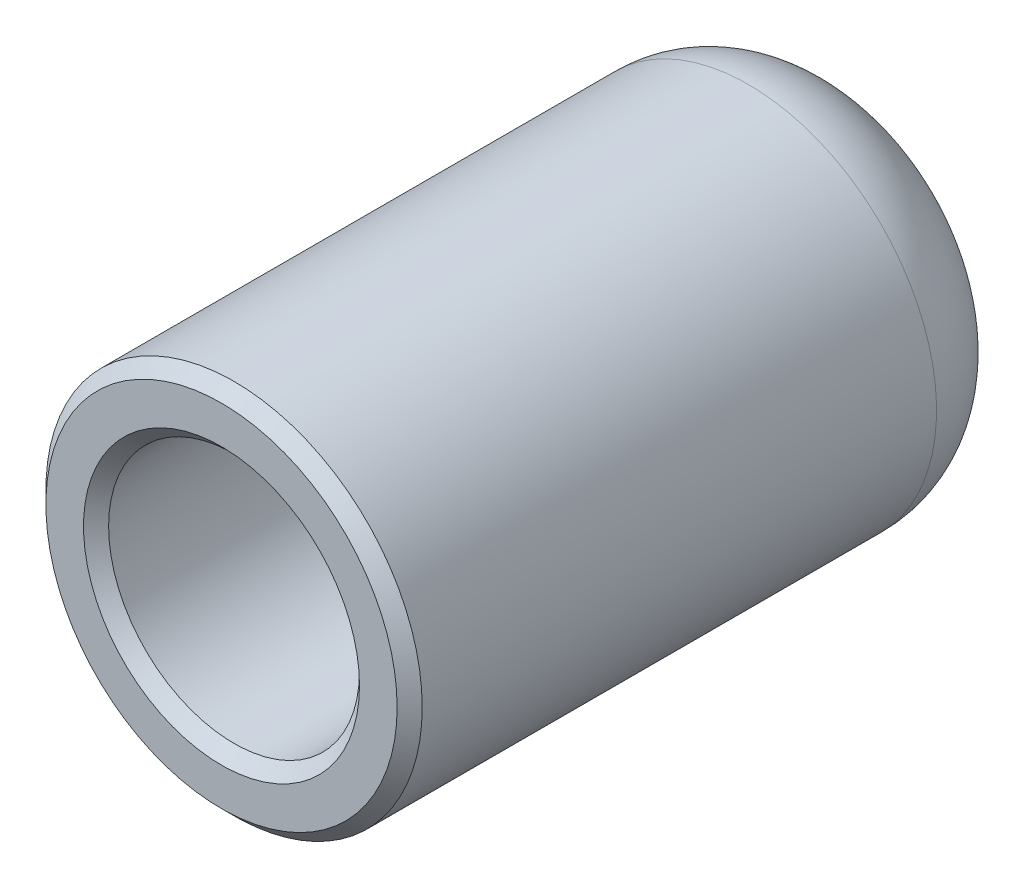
SolidWorks part; units mm, degrees
ref_plane "Front Plane" through (0, 0, 0) normal (0, 0, 1) x (1, 0, 0)
ref_plane "Top Plane" through (0, 0, 0) normal (0, 1, 0) x (1, 0, 0)
ref_plane "Right Plane" through (0, 0, 0) normal (1, 0, 0) x (0, 0, -1)
sketch "Sketch1" plane through (0, 0, 0) normal (0, 0, 1) x (1, 0, 0)
  circle A0 centre (0, 0) radius 7.5
  dimension "D1" = 15
extrude "Boss-Extrude1" add sketch "Sketch1" along normal blind 25
sketch "Sketch2" plane through (0, 0, 0) normal (0, 0, -1) x (-1, 0, 0)
  line L7 (1.4497, 3.5) -> (-1.4497, 3.5)
  line L8 (-1.4497, 3.5) -> (-3.5, 1.4497)
  line L9 (-3.5, 1.4497) -> (-3.5, -1.4497)
  line L10 (-3.5, -1.4497) -> (-1.4497, -3.5)
  line L11 (-1.4497, -3.5) -> (1.4497, -3.5)
  line L12 (1.4497, -3.5) -> (3.5, -1.4497)
  line L13 (3.5, -1.4497) -> (3.5, 1.4497)
  line L14 (3.5, 1.4497) -> (1.4497, 3.5)
  circle A0 centre (0, 0) radius 3.5 construction
  dimension "D1" = 7
sketch "Sketch4" plane through (0, 0, 0) normal (0, 0, -1) x (-1, 0, 0)
  circle A0 centre (0, 0) radius 2.5
  dimension "D1" = 5
extrude "Cut-Extrude2" cut sketch "Sketch4" against normal through all
sketch "Sketch5" plane through (0, 0, 25) normal (0, 0, 1) x (1, 0, 0)
  circle A0 centre (0, 0) radius 5
  dimension "D1" = 10
extrude "Cut-Extrude3" cut sketch "Sketch5" against normal blind 12
chamfer "Chamfer1" distance 0.5 angle 45 2 edges at (5, 0, 25) (7.5, 0, 25)
fillet "Fillet2" radius 4 1 edges at (7.5, 0, 0)
sketch "Sketch3" plane through (0, 0, 0) normal (1, 0, 0) x (0, 0, -1)
  line L14 (-4.3, -7.5) -> (0, -3.2167)
  line L15 (0, -3.2167) -> (0, -7.5)
  line L16 (0, -7.5) -> (-4.3, -7.5)
  dimension "D1" = 4.3
  dimension "D2" = 4.2833
extrude "Cut-Extrude1" cut sketch "Sketch3" against normal through all both and the other way through all
extrude "Cut-Extrude4" cut sketch "Sketch2" against normal blind 10 contours L8 L9 L10 L11 L12 L13 L14 L7
